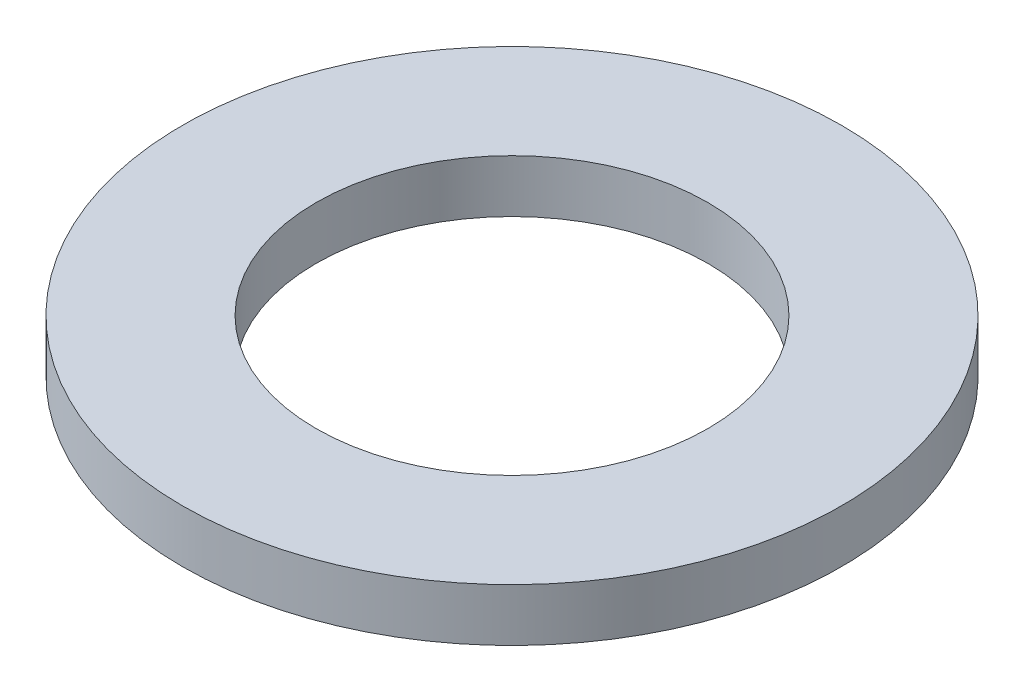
SolidWorks part; units mm, degrees
ref_plane "Front" through (0, 0, 0) normal (0, 0, 1) x (1, 0, 0)
ref_plane "Top" through (0, 0, 0) normal (0, 1, 0) x (1, 0, 0)
ref_plane "Right" through (0, 0, 0) normal (1, 0, 0) x (0, 0, -1)
sketch "Sketch1" plane through (0, 0, 0) normal (0, 1, 0) x (1, 0, 0)
  circle A0 centre (0, 0) radius 52
  circle A1 centre (0, 0) radius 87.5
extrude "Extrude1" add sketch "Sketch1" along normal blind 14
